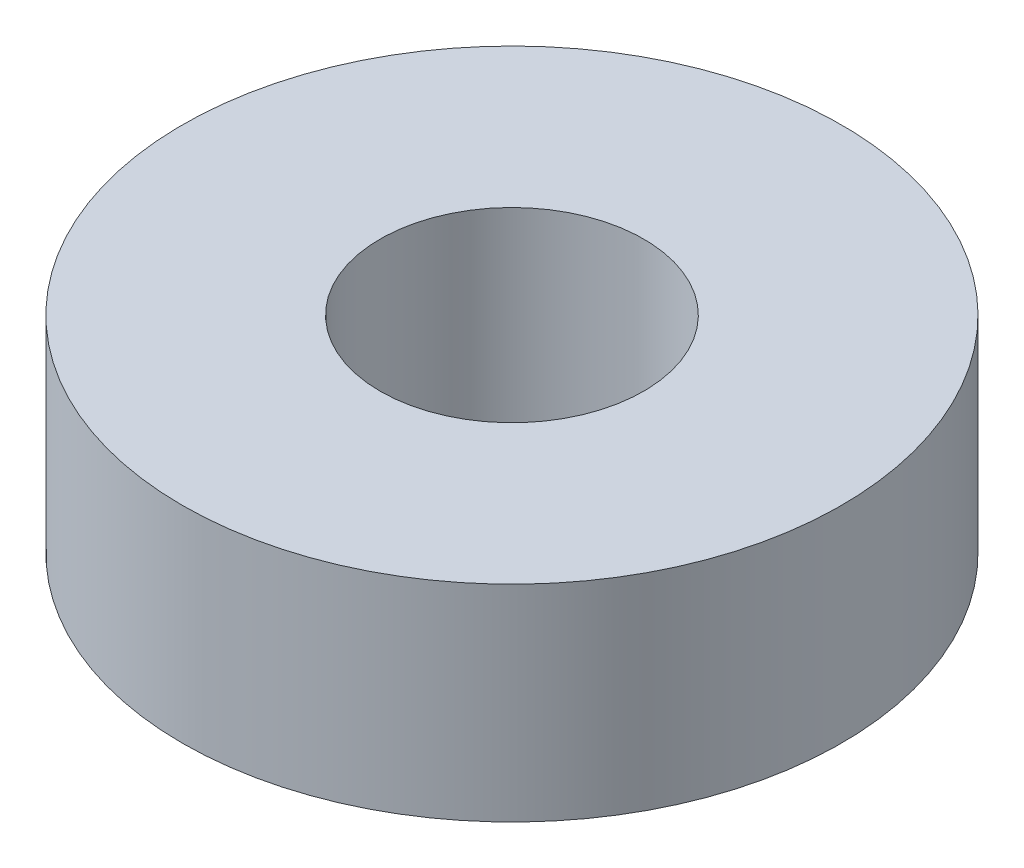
SolidWorks part; units mm, degrees
ref_plane "FRONT" through (0, 0, 0) normal (0, 0, 1) x (1, 0, 0)
ref_plane "TOP" through (0, 0, 0) normal (0, 1, 0) x (1, 0, 0)
ref_plane "RIGHT" through (0, 0, 0) normal (1, 0, 0) x (0, 0, -1)
sketch "Sketch1" plane through (0, 0, 0) normal (0, 1, 0) x (1, 0, 0)
  circle A0 centre (0, 0) radius 6.35
  circle A1 centre (0, 0) radius 2.54
  dimension "D1" = 12.7
  dimension "D2" = 5.08
extrude "Base-Extrude" add sketch "Sketch1" along normal blind 3.9688
